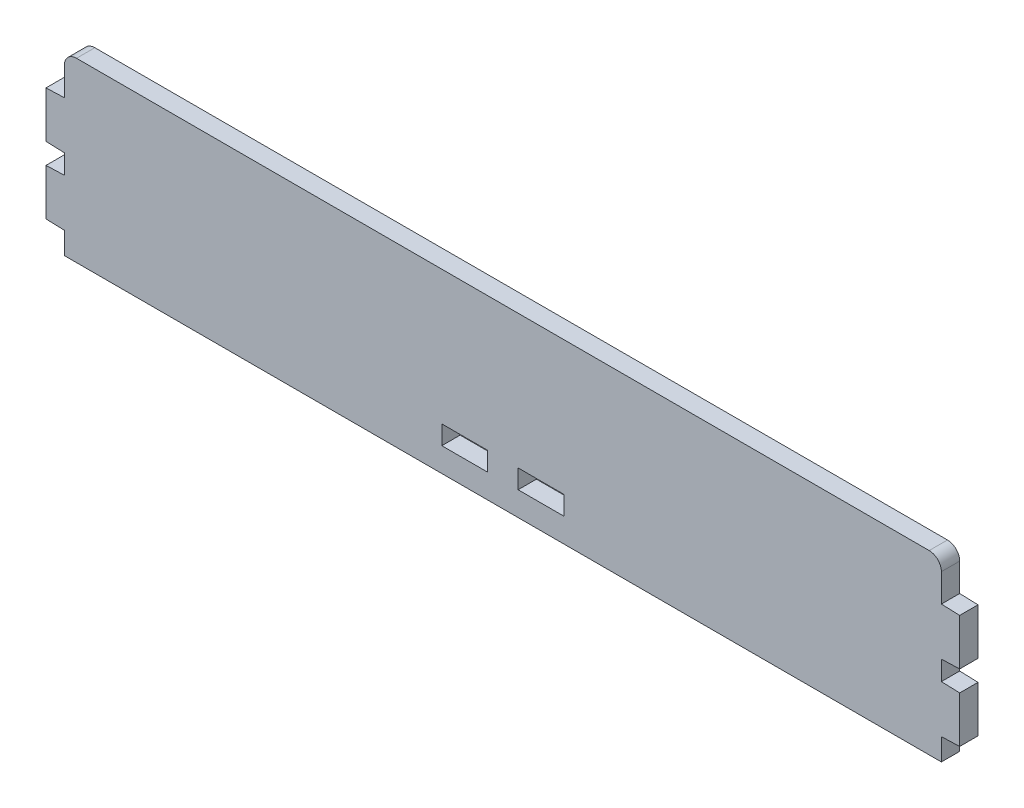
SolidWorks part; units mm, degrees
ref_plane "Front" through (0, 0, 0) normal (0, 0, 1) x (1, 0, 0)
ref_plane "Top" through (0, 0, 0) normal (0, 1, 0) x (1, 0, 0)
ref_plane "Right" through (0, 0, 0) normal (1, 0, 0) x (0, 0, -1)
sketch "Sketch1" plane through (0, 0, 0) normal (0, 0, 1) x (1, 0, 0)
  line L0 (-140.9, 52) -> (-140.9, 16) construction
  line L1 (-140.9, 66) -> (146.5, 66)
  line L2 (-140.9, 66) -> (-140.9, 8)
  line L3 (-140.9, 8) -> (146.5, 8)
  line L4 (146.5, 66) -> (146.5, 8)
  line L5 (-140.9, 8) -> (-146.9, 8) construction
  line L6 (-68.5, 66) -> (148.5, 66) construction
  line L7 (152.5, 55.7147) -> (152.5, 29.7273) construction
  line L8 (152.5, 72) -> (152.5, 66) construction
  dimension "D1" = 6
extrude "Boss-Extrude1" add sketch "Sketch1" along normal blind 6
sketch "Sketch2" plane through (0, 0, 6) normal (0, 0, 1) x (1, 0, 0)
  line L2 (-140.9, 66) -> (-140.9, 8) construction
  line L3 (-140.9, 8) -> (146.5, 8) construction
  line L4 (146.5, 8) -> (146.5, 66) construction
  line B0 (-146.9, 23) -> (-140.9, 23) construction
  line B1 (-140.9, 15.1905) -> (-140.9, 30.8095)
  line B2 (-140.9, 30.8095) -> (-146.9, 30.6)
  line B3 (-146.9, 30.6) -> (-146.9, 15.4)
  line B4 (-140.9, 15.1905) -> (-146.9, 15.4)
  line B5 (-146.9, 45) -> (-140.9, 45) construction
  line B6 (-140.9, 37.1905) -> (-140.9, 52.8095)
  line B7 (-140.9, 52.8095) -> (-146.9, 52.6)
  line B8 (-146.9, 52.6) -> (-146.9, 37.4)
  line B9 (-140.9, 37.1905) -> (-146.9, 37.4)
  line B10 (152.5, 23) -> (146.5, 23) construction
  line B11 (146.5, 30.8095) -> (146.5, 15.1905)
  line B12 (146.5, 15.1905) -> (152.5, 15.4)
  line B13 (152.5, 15.4) -> (152.5, 30.6)
  line B14 (146.5, 30.8095) -> (152.5, 30.6)
  line B15 (152.5, 45) -> (146.5, 45) construction
  line B16 (146.5, 52.8095) -> (146.5, 37.1905)
  line B17 (146.5, 37.1905) -> (152.5, 37.4)
  line B18 (152.5, 37.4) -> (152.5, 52.6)
  line B19 (146.5, 52.8095) -> (152.5, 52.6)
  dimension "D1" = 22
  dimension "D2" = 15
sketch_block_instance "Block-laser-cut-tab-15x6-1"
sketch_block "Block-laser-cut-tab-15x6" parameters "D1"=6, "D2"=15.2, "D3"=88
sketch_block_instance "Block-laser-cut-tab-15x6-2"
sketch_block_instance "Block-laser-cut-tab-15x6-3"
sketch_block_instance "Block-laser-cut-tab-15x6-4"
extrude "end tabs" add sketch "Sketch2" against normal up to surface (6 mm away)
fillet "Fillet1" radius 4 2 edges at (-140.9, 66, 3) (146.5, 66, 3)
sketch "Sketch3" plane through (0, 0, 6) normal (0, 0, 1) x (1, 0, 0)
  line L0 (-140.9, 8) -> (146.5, 8) construction
  line L1 (-34.7, 16) -> (40.3, 16) construction
  line L2 (-34.7, 16) -> (-34.7, 22) construction
  line L3 (-34.7, 22) -> (40.3, 22) construction
  line L4 (40.3, 16) -> (40.3, 22) construction
  line L5 (2.8, 8) -> (2.8, 66) construction
  line L6 (142.5, 66) -> (-136.9, 66) construction
  point P12 (-34.7, 19)
  line B0 (-17.2, 15.9) -> (-2.2, 15.9)
  line B1 (-2.2, 15.9) -> (-2.2, 22.1)
  line B2 (-2.2, 22.1) -> (-17.2, 22.1)
  line B3 (-17.2, 22.1) -> (-17.2, 15.9)
  line B4 (-17.2, 19) -> (-2.2, 19) construction
  line B5 (-9.7, 22.1) -> (-9.7, 15.9) construction
  line B6 (7.8, 15.9) -> (22.8, 15.9)
  line B7 (22.8, 15.9) -> (22.8, 22.1)
  line B8 (22.8, 22.1) -> (7.8, 22.1)
  line B9 (7.8, 22.1) -> (7.8, 15.9)
  line B10 (7.8, 19) -> (22.8, 19) construction
  line B11 (15.3, 22.1) -> (15.3, 15.9) construction
  dimension "D1" = 8
  dimension "D2" = 75
  dimension "D3" = 6
  dimension "D4" = 25
sketch_block_instance "Block-laser-cut-slot-15x6-1"
sketch_block "Block-laser-cut-slot-15x6" parameters "D1"=15, "D2"=6.2
sketch_block_instance "Block-laser-cut-slot-15x6-2"
extrude "Cut-Extrude1" cut sketch "Sketch3" against normal up to next
